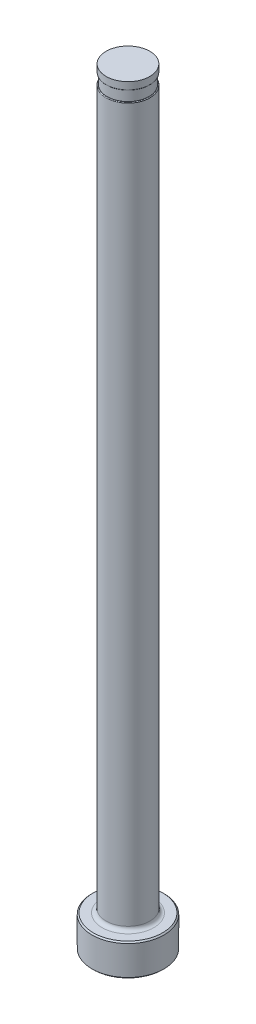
SolidWorks part; units mm, degrees
ref_plane "Front Plane" through (0, 0, 0) normal (0, 0, 1) x (1, 0, 0)
ref_plane "Top Plane" through (0, 0, 0) normal (0, 1, 0) x (1, 0, 0)
ref_plane "Right Plane" through (0, 0, 0) normal (1, 0, 0) x (0, 0, -1)
other "Configuration Table"
sketch "Sketch1" plane through (0, 0, 0) normal (0, 0, 1) x (1, 0, 0)
  line L0 (0, 259.9588) -> (0, -15.1925) construction
  line L1 (0, 0) -> (-7.1374, 0)
  line L2 (-7.1374, 0) -> (-7.1374, 6.35)
  line L3 (-7.1374, 6.35) -> (-4.365, 6.35)
  line L4 (-4.365, 6.35) -> (-4.365, 152.4)
  line L5 (-4.365, 152.4) -> (0, 152.4)
  line L6 (0, 152.4) -> (0, 0)
  dimension "L" = 152.4
  dimension "H" = 14.2748
  dimension "T" = 6.35
  dimension "D" = 8.73
revolve "Revolve1" add sketch "Sketch1" angle 360 about L0
chamfer "Chamfer1" distance 0.254 angle 45 2 edges at (0, 6.35, 7.1374) (0, 0, 7.1374)
fillet "Fillet1" radius 0.762 1 edges at (0, 6.35, 4.365)
sketch "Sketch2" plane through (0, 0, 0) normal (0, 0, 1) x (1, 0, 0)
  line L0 (-4.365, 152.4) -> (-4.365, 7.112) construction
  line L1 (-4.365, 150.876) -> (-4.1618, 150.876)
  line L2 (-4.365, 150.876) -> (-4.365, 148.844)
  line L3 (-4.365, 148.844) -> (-4.1618, 148.844)
  line L4 (-4.1618, 150.876) -> (-4.1618, 148.844)
  line L5 (4.365, 152.4) -> (-4.365, 152.4) construction
  line L6 (0, 153.4483) -> (0, 147.3282) construction
  dimension "D1" = 2.032
  dimension "N" = 1.524
  dimension "FD" = 0.2032
  dimension "D3" = 8.3236
revolve "Vent Relief" cut sketch "Sketch2" angle 360 about L6
sketch "Sketch3" plane through (0, 0, 0) normal (0, 0, 1) x (1, 0, 0)
  line L0 (-4.1618, 149.86) -> (-4.1618, 86.36)
  line L1 (-4.1618, 150.876) -> (-4.1618, 148.844) construction
  line L2 (-4.365, 148.844) -> (-4.365, 7.112) construction
  line L3 (-4.365, 85.2424) -> (-4.365, 149.86)
  line L4 (-4.365, 149.86) -> (-4.1618, 149.86)
  arc A0 (-4.1618, 86.36) -> (-4.365, 85.2424) centre (-7.3368, 86.36) cw
  dimension "D1" = 3.175
  dimension "D2" = 63.5
extrude "D-Slot" cut sketch "Sketch3" against normal through all both and the other way through all
sketch "Sketch5" plane through (0, 0, 0) normal (0, 0, 1) x (1, 0, 0)
  line L0 (-4.365, 150.876) -> (4.365, 150.876) construction
  line L1 (-4.365, 152.4) -> (-4.3396, 152.4)
  line L2 (-4.365, 152.4) -> (-4.365, 150.876)
  line L3 (-4.365, 150.876) -> (-4.3396, 150.876)
  line L4 (-4.3396, 152.4) -> (-4.3396, 150.876)
  line L5 (0, 152.6877) -> (0, 150.5771) construction
  dimension "VP" = 0.0254
revolve "Vent Diameter" cut sketch "Sketch5" angle 360 about L5
fillet "Fillet2" radius 0.127 2 edges at (4.365, 148.844, 0) (0, 150.876, 4.3396)
sketch "Pocket Sketch" plane through (0, 0, 0) normal (0, 0, 1) x (1, 0, 0)
  line L0 (-7.5343, 0) -> (-7.5343, 6.3754)
  line L1 (-7.5343, 6.3754) -> (-5.3254, 6.3754)
  line L2 (-4.5634, 7.1374) -> (-4.5634, 22.225)
  line L3 (-4.5634, 22.225) -> (0, 22.225)
  line L4 (0, 22.225) -> (0, 0)
  line L5 (0, 0) -> (-7.5343, 0)
  line L6 (0, 12.6104) -> (0, -2.4989) construction
  line L7 (-7.1374, 6.096) -> (-7.1374, 0.254) construction
  line L8 (6.8834, 6.35) -> (-6.8834, 6.35) construction
  line L9 (-4.365, 85.2424) -> (-4.365, 7.112) construction
  line L10 (-5.3254, 6.3754) -> (-4.5634, 7.1374)
  point P3 (-4.5634, 6.3754)
  dimension "D1" = 15.0685
  dimension "D2" = 0.3969
  dimension "D3" = 0.0254
  dimension "D4" = 0.1984
  dimension "D5" = 9.1269
  dimension "D6" = 22.225
